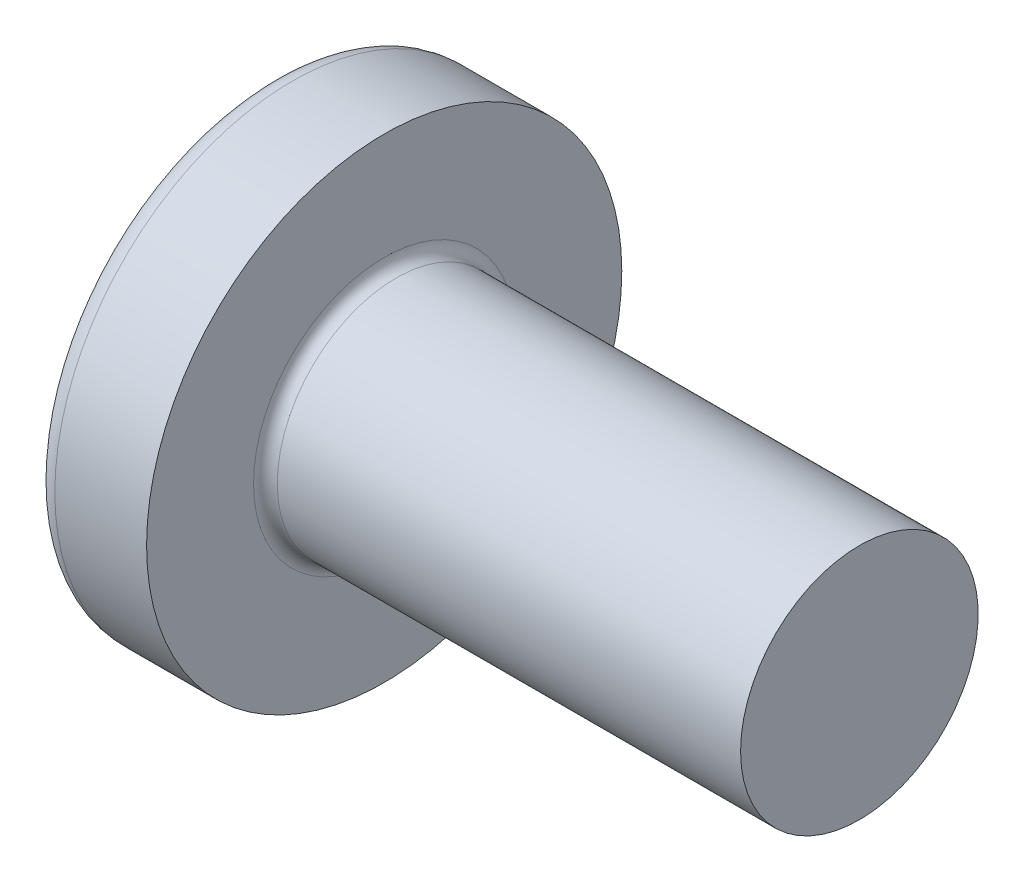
SolidWorks part; units mm, degrees
ref_plane "Plane1" through (0, 0, 0) normal (0, 0, 1) x (1, 0, 0)
ref_plane "Plane2" through (0, 0, 0) normal (0, 1, 0) x (1, 0, 0)
ref_plane "Plane3" through (0, 0, 0) normal (1, 0, 0) x (0, 0, -1)
revolve "Base-Revolve" add sketch "BodySke"
sketch "BodySke" plane through (0, 0, 0) normal (0, 0, 1) x (1, 0, 0)
  line L0 (3.1, 2) -> (3.1, 4)
  line L1 (3.45, 6.35) -> (3.45, -3.175) construction
  line L2 (-25.4, 0) -> (127, 0) construction
  line L3 (11.1, 0) -> (0, 0)
  line L4 (3.1, 2) -> (11.1, 2)
  line L5 (11.1, 2) -> (11.1, 0)
  line L6 (1.5553, 4) -> (3.1, 4)
  line L8 (3.1, 6.35) -> (3.1, -3.175) construction
  arc A0 (1.2654, 3.8534) -> (0, 0) centre (6.5, 0) ccw
  arc A2 (1.2654, 3.8534) -> (1.5553, 4) centre (1.5553, 3.64) cw
  dimension "Head_fillet_rad" = 0.36
  dimension "Head_crown_rad" = 6.5
  dimension "Head_ht" = 3.1
  dimension "Diameter" = 4
  dimension "Length" = 8
  dimension "Head_dia" = 8
  dimension "Advance" = 0.7
  dimension "Thread_nom" = 8
fillet "Fillet1" radius 0.2 1 edges at (3.1, 0, 2)
sketch "Sketch3" plane through (0, 0, 0) normal (1, 0, 0) x (0, 0, -1)
  line L0 (0.515, -2.15) -> (-0.515, -2.15)
  line L1 (0.515, -2.15) -> (0.515, 2.15)
  line L2 (-0.515, 2.15) -> (0.515, 2.15)
  line L3 (-0.515, 2.15) -> (-0.515, -2.15)
  dimension "D1" = 2.15
  dimension "Cross_dia" = 4.3
  dimension "D2" = 0.515
  dimension "Cross_width" = 1.03
ref_plane "Plane4" through (2.34, 0, 0) normal (1, 0, 0) x (0, 0, -1)
sketch "Sketch4" plane through (2.34, 0, 0) normal (1, 0, 0) x (0, 0, -1)
  line L0 (0.515, -0.9833) -> (-0.515, -0.9833)
  line L1 (0.515, -0.9833) -> (0.515, 0.9833)
  line L2 (-0.515, 0.9833) -> (0.515, 0.9833)
  line L3 (-0.515, 0.9833) -> (-0.515, -0.9833)
  dimension "D1" = 1.03
  dimension "D2" = 1.9666
  dimension "D3" = 0.515
  dimension "D4" = 0.9833
loft "Recess" cut profiles "Sketch3", "Sketch4"
pattern_circular "RecPat" count 2 every 90 about axis through (0, 0, 0) along (1, 0, 0) of "Recess"
sketch "RecCorSke" plane through (0, 0, 0) normal (0, 0, 1) x (1, 0, 0)
  line L0 (-3.175, 0) -> (15.875, 0) construction
  line L1 (-25.4, 0) -> (127, 0) construction
  line L2 (0, 0) -> (0, 1.0146)
  line L3 (0, 1.0146) -> (2.34, 0.851)
  line L4 (2.34, 0.851) -> (2.6165, 0)
  line L5 (2.6165, 0) -> (0, 0)
  dimension "Diameter" = 1.702
  dimension "Depth" = 2.34
  dimension "Draft_angle" = 4
  dimension "Bottom_angle" = 18
revolve "RecessCore" cut sketch "RecCorSke" angle 360 about L0
sketch "ThdSchSke" plane through (0, 0, 0) normal (0, 0, 1) x (1, 0, 0)
  line L0 (4.5, -1.61) -> (4.2269, -2)
  line L1 (4.5, -1.61) -> (4.7731, -2)
  line L2 (4.7731, -2) -> (4.7731, -2.5)
  line L3 (-3.175, 0) -> (5.1513, 0) construction
  line L5 (4.7731, -2.5) -> (4.2269, -2.5)
  line L6 (4.2269, -2.5) -> (4.2269, -2)
  dimension "Thread_minor" = 3.22
  dimension "Diameter" = 4
  dimension "Start" = 4.5
  dimension "SideAngle" = 55
  dimension "VeeAngle" = 70
  dimension "Overcut" = 5
revolve "ThreadSchematic" [suppressed] cut sketch "ThdSchSke" angle 360 about L3
pattern_linear "ThdSchPat" [suppressed]
equation "\"D1@Sketch3\" = \"Cross_dia@Sketch3\" / 2"
equation "\"D2@Sketch3\" = \"Cross_width@Sketch3\" / 2"
equation "\"Depth@RecCorSke\" = \"Cross_depth@Plane4\""
equation "\"D1@Sketch4\" = \"Cross_width@Sketch3\""
equation "\"D2@Sketch4\" = \"Cross_dia@Sketch3\" - 2.0 * \"Cross_depth@Plane4\" * tan(26.5  * 0.017453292)"
equation "\"D3@Sketch4\" = \"D1@Sketch4\" / 2"
equation "\"D4@Sketch4\" = \"D2@Sketch4\" / 2"
equation "\"Thread_length@ThreadCosmetic\" = ((sgn( (\"Length@BodySke\" - \"Advance@BodySke\" * 2.0 ) - \"Thread_nom@BodySke\" )-1)*( (\"Length@BodySke\" - \"Advance@BodySke\" * 2.0 ) - \"Thread_nom@BodySke\" ))/-2+ \"Thread_"
equation "\"Thread_minor@ThdSchSke\" = \"Thread_minor@ThreadCosmetic\""
equation "\"Diameter@ThdSchSke\" = \"Diameter@BodySke\""
equation "\"Overcut@ThdSchSke\" = \"Diameter@BodySke\" * 1.25"
equation "\"Start@ThdSchSke\" = \"Head_ht@BodySke\" + \"Length@BodySke\" - \"Thread_length@ThreadCosmetic\"  '---Non-countersunk---"
equation "\"Num_threads@ThdSchPat\" = int( \"Thread_length@ThreadCosmetic\" / \"Advance@BodySke\" + 0.999 )  + 1"
equation "\"Advance@ThdSchPat\" = \"Thread_length@ThreadCosmetic\" /  (\"Num_threads@ThdSchPat\" - 1) 'relax it"
